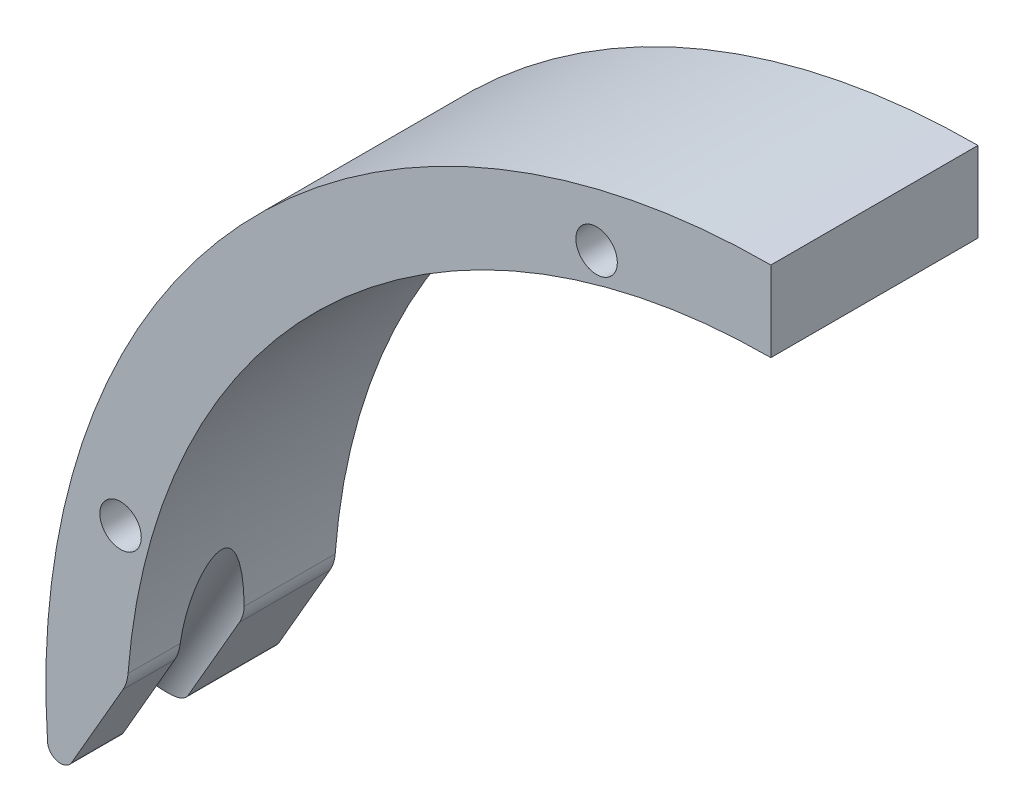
SolidWorks part; units mm, degrees
ref_plane "Vorne" through (0, 0, 0) normal (0, 0, 1) x (1, 0, 0)
ref_plane "Oben" through (0, 0, 0) normal (0, 1, 0) x (1, 0, 0)
ref_plane "Rechts" through (0, 0, 0) normal (1, 0, 0) x (0, 0, -1)
sketch "Skizze1" plane through (0, 0, 0) normal (0, 0, 1) x (1, 0, 0)
  line L0 (0, 56) -> (0, 49.8)
  line L1 (0, 0) -> (-38.7251, 0) construction
  line L3 (-49.8, 0) -> (-55.2104, -9.371)
  arc A0 (-49.8, 0) -> (0, 49.8) centre (0, 0) cw
  arc A1 (-55.2104, -9.371) -> (0, 56) centre (0, 0) cw
  dimension "D1" = 49.8
  dimension "D2" = 56
  dimension "D3" = 30
extrude "Linear austragen1" add sketch "Skizze1" along normal blind 16
hole_wizard "Ø3.2 (3.2) Durchmesser Bohrung1" positions "Skizze3" profile "Skizze2" hole size "Ø3.2" standard "ISO"
sketch "Skizze3" plane through (0, 0, 16) normal (0, 0, 1) x (1, 0, 0)
  line L0 (-13.4586, 50.2281) -> (0, 0) construction
  line L1 (0, 0) -> (-50.2281, 13.4586) construction
  line L3 (0, 49.8) -> (0, 56) construction
  line L5 (0, 0) -> (-0.6548, 0.1755) construction
  line L6 (0, 0) -> (-27.9601, 0)
  arc A0 (-50.2281, 13.4586) -> (-13.4586, 50.2281) centre (0, 0) cw
  point P0 (-50.2281, 13.4586)
  point P1 (-13.4586, 50.2281)
  dimension "D1" = 52
  dimension "D2" = 15
  dimension "D3" = 15
sketch "Skizze2" plane through (-50.2281, 13.4586, 16) normal (1, 0, 0) x (0, -1, 0)
  line L0 (0, 0) -> (0, 16)
  line L1 (0, 16) -> (1.6, 16)
  line L2 (1.6, 16) -> (1.6, 0)
  line L5 (1.6, 0) -> (0, 0)
  line L11 (0, -6.35) -> (0, 107.95) construction
  dimension "Bohrerdurchmesser" = 3.2
  dimension "Bohrungstiefe" = 16
ref_plane "Ebene2" through (0, 0, 0) normal (0.5, 0.866, 0) x (-0.866, 0.5, 0)
ref_plane "Ebene3" through (-20.5, -35.507, 0) normal (0.5, 0.866, 0) x (-0.866, 0.5, 0)
sketch "Skizze8" plane through (0, 0, 16) normal (0, 0, 1) x (1, 0, 0)
  line L0 (-55.2104, -9.371) -> (-48.322, 2.5599)
  line L1 (-48.322, 2.5599) -> (-48.322, 5.5599)
  line L2 (-48.322, 5.5599) -> (-56.9424, -9.371)
  line L3 (-56.9424, -9.371) -> (-55.2104, -9.371)
  line L4 (-55.2104, -9.371) -> (-49.8, 0) construction
  dimension "D1" = 1.5
extrude "Linear austragen5" cut sketch "Skizze8" against normal through all
sketch "Skizze6" plane through (-20.5, -35.507, 0) normal (0.5, 0.866, 0) x (-0.866, 0.5, 0)
  line L0 (24.9, 0) -> (49.8, 0) construction
  line L1 (44.5, 12) -> (40.5, 12)
  line L2 (40.5, 12) -> (40.5, 7)
  line L3 (40.5, 7) -> (44.5, 7)
  arc A0 (44.5, 7) -> (44.5, 12) centre (44.5, 9.5) ccw
  dimension "D1" = 5
  dimension "D2" = 9.5
  dimension "D3" = 44.5
  dimension "D4" = 4
extrude "Linear austragen3" cut sketch "Skizze6" along normal blind 47
fillet "Verrundung3" radius 1 2 edges at (-55.5631, -6.9819, 13.9984) (-55.5631, -6.9819, 3.5016)
fillet "Verrundung4" radius 3 2 edges at (-49.6987, 3.1755, 3.5016) (-49.6987, 3.1755, 13.9984)
